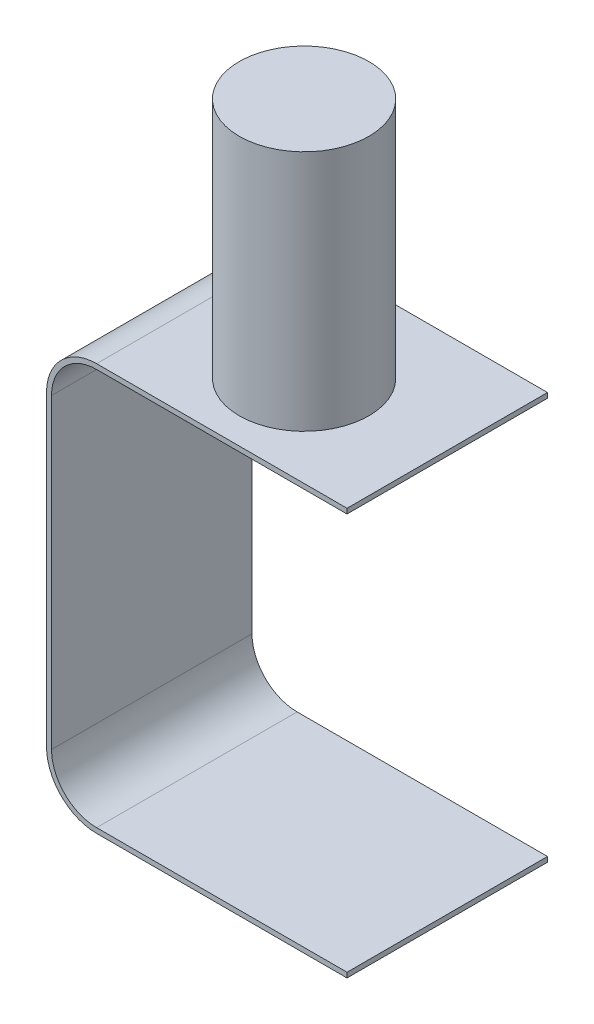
SolidWorks part; units mm, degrees
ref_plane "Front Plane" through (0, 0, 0) normal (0, 0, 1) x (1, 0, 0)
ref_plane "Top Plane" through (0, 0, 0) normal (0, 1, 0) x (1, 0, 0)
ref_plane "Right Plane" through (0, 0, 0) normal (1, 0, 0) x (0, 0, -1)
sketch "Sketch2" plane through (0, 0, 0) normal (0, 0, 1) x (1, 0, 0)
  line L0 (0, 0) -> (-126.9006, 0)
  line L1 (-152.3006, 25.4) -> (-152.3006, 180.7756)
  line L2 (-126.9006, 206.1756) -> (0, 206.1756)
  arc A0 (-126.9006, 0) -> (-152.3006, 25.4) centre (-126.9006, 25.4) cw
  arc A1 (-152.3006, 180.7756) -> (-126.9006, 206.1756) centre (-126.9006, 180.7756) cw
  dimension "D1" = 25.4
extrude "Extrude-Thin1" add sketch "Sketch2" along normal blind 101.6 thin
sketch "Sketch3" plane through (0, 206.1756, 0) normal (0, 1, 0) x (1, 0, 0)
  circle A0 centre (-67.8482, -55.5028) radius 32.8441
extrude "Extrude1" add sketch "Sketch3" along normal blind 122.682 separate body
